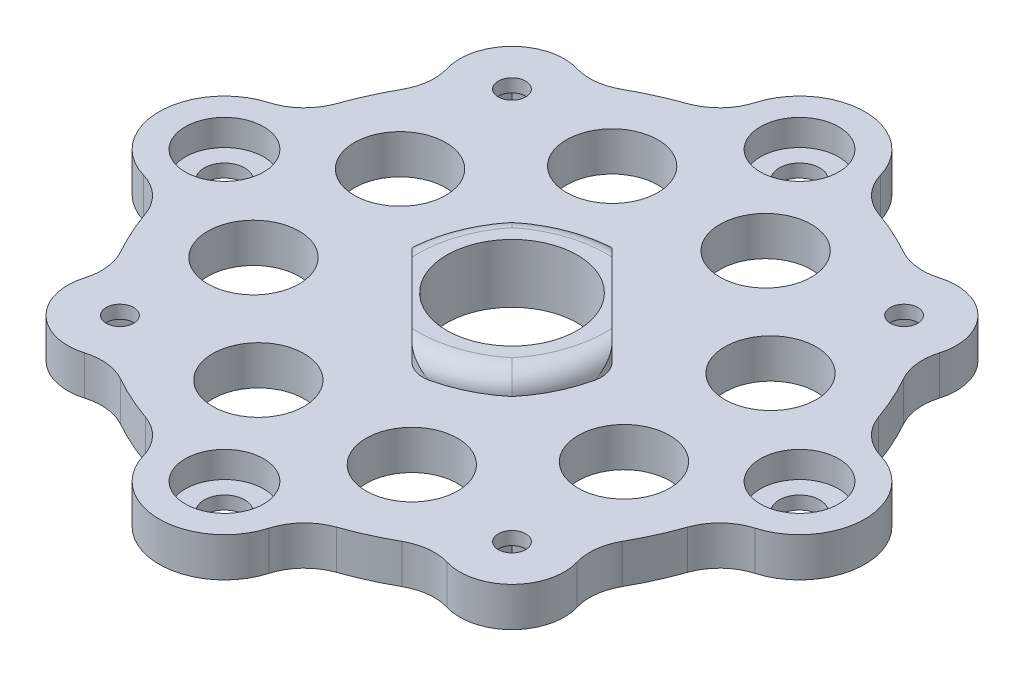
SolidWorks part; units mm, degrees
ref_plane "Front Plane" through (0, 0, 0) normal (0, 0, 1) x (1, 0, 0)
ref_plane "Top Plane" through (0, 0, 0) normal (0, 1, 0) x (1, 0, 0)
ref_plane "Right Plane" through (0, 0, 0) normal (1, 0, 0) x (0, 0, -1)
sketch "Sketch3" plane through (0, 0, 0) normal (0, 1, 0) x (1, 0, 0)
  circle A0 centre (0, 0) radius 22
  dimension "D1" = 44
extrude "Boss-Extrude2" add sketch "Sketch3" along normal blind 3
sketch "Sketch4" plane through (0, 3, 0) normal (0, 1, 0) x (1, 0, 0)
  line L0 (0, 0) -> (-39.2459, 0) construction
  circle A0 centre (-22, 0) radius 5
  circle A1 centre (0, 0) radius 22 construction
  circle A3 centre (0, 22) radius 5
  circle A4 centre (22, 0) radius 5
  circle A5 centre (0, -22) radius 5
  point P16 (0, 0)
  dimension "D1" = 10
  dimension "D2" = 4
extrude "Boss-Extrude3" add sketch "Sketch4" against normal blind 3
sketch "Sketch5" plane through (0, 3, 0) normal (0, 1, 0) x (1, 0, 0)
  circle A0 centre (-22, 0) radius 1.55
  circle A1 centre (22, 0) radius 1.55
  circle A2 centre (0, 22) radius 1.55
  circle A3 centre (0, -22) radius 1.55
  dimension "D1" = 3.1
extrude "Cut-Extrude1" cut sketch "Sketch5" against normal through all
sketch "Sketch6" plane through (0, 3, 0) normal (0, 1, 0) x (1, 0, 0)
  circle A0 centre (0, 22) radius 3
  circle A1 centre (22, 0) radius 3
  circle A2 centre (-22, 0) radius 3
  circle A3 centre (0, -22) radius 3
  dimension "D1" = 6
extrude "Cut-Extrude2" cut sketch "Sketch6" against normal blind 2
sketch "Sketch7" plane through (0, 0, 0) normal (0, -1, 0) x (1, 0, 0)
  line L1 (-15, 15) -> (15, 15) construction
  line L2 (-15, 15) -> (-15, -15) construction
  line L3 (-15, -15) -> (15, -15) construction
  line L4 (15, 15) -> (15, -15) construction
  line L5 (-15, 15) -> (15, -15) construction
  line L6 (-15, -15) -> (15, 15) construction
  circle A0 centre (15, -15) radius 4
  circle A1 centre (-15, -15) radius 4
  circle A2 centre (-15, 15) radius 4
  circle A3 centre (15, 15) radius 4
  point P0 (0, 0)
  dimension "D2" = 8
  dimension "D1" = 30
extrude "Boss-Extrude4" add sketch "Sketch7" against normal through all
sketch "Sketch8" plane through (0, 0, 0) normal (0, -1, 0) x (1, 0, 0)
  circle A0 centre (15, 15) radius 1.05
  circle A1 centre (-15, 15) radius 1.05
  circle A2 centre (-15, -15) radius 1.05
  circle A3 centre (15, -15) radius 1.05
  arc A5 (18.1125, 12.4875) -> (12.4875, 18.1125) centre (15, 15) ccw construction
  dimension "D1" = 2.1
extrude "Cut-Extrude3" cut sketch "Sketch8" against normal through all
sketch "Sketch9" plane through (0, 0, 0) normal (0, -1, 0) x (1, 0, 0)
  line L0 (0, 0) -> (15, 15) construction
  line L1 (16.633, 16.633) -> (14.4023, 17.2307)
  line L2 (14.4023, 17.2307) -> (12.7693, 15.5977)
  line L3 (12.7693, 15.5977) -> (13.367, 13.367)
  line L4 (13.367, 13.367) -> (15.5977, 12.7693)
  line L5 (15.5977, 12.7693) -> (17.2307, 14.4023)
  line L6 (17.2307, 14.4023) -> (16.633, 16.633)
  line L7 (0, 0) -> (-15, 15) construction
  line L8 (-15, -15) -> (0, 0) construction
  line L9 (0, 0) -> (15, -15) construction
  line L11 (-13.367, 13.367) -> (-12.7693, 15.5977)
  line L12 (-12.7693, 15.5977) -> (-14.4023, 17.2307)
  line L13 (-14.4023, 17.2307) -> (-16.633, 16.633)
  line L14 (-16.633, 16.633) -> (-17.2307, 14.4023)
  line L15 (-17.2307, 14.4023) -> (-15.5977, 12.7693)
  line L16 (-15.5977, 12.7693) -> (-13.367, 13.367)
  line L17 (-13.367, -13.367) -> (-15.5977, -12.7693)
  line L18 (-15.5977, -12.7693) -> (-17.2307, -14.4023)
  line L19 (-17.2307, -14.4023) -> (-16.633, -16.633)
  line L20 (-16.633, -16.633) -> (-14.4023, -17.2307)
  line L21 (-14.4023, -17.2307) -> (-12.7693, -15.5977)
  line L22 (-12.7693, -15.5977) -> (-13.367, -13.367)
  line L23 (13.367, -13.367) -> (12.7693, -15.5977)
  line L24 (12.7693, -15.5977) -> (14.4023, -17.2307)
  line L25 (14.4023, -17.2307) -> (16.633, -16.633)
  line L26 (16.633, -16.633) -> (17.2307, -14.4023)
  line L27 (17.2307, -14.4023) -> (15.5977, -12.7693)
  line L28 (15.5977, -12.7693) -> (13.367, -13.367)
  circle A0 centre (15, 15) radius 2 construction
  circle A1 centre (-15, 15) radius 2 construction
  circle A2 centre (-15, -15) radius 2 construction
  circle A3 centre (15, -15) radius 2 construction
  dimension "D1" = 4
extrude "Cut-Extrude4" cut sketch "Sketch9" against normal blind 2
sketch "Sketch10" plane through (0, 3, 0) normal (0, 1, 0) x (1, 0, 0)
  line L0 (7.65, -3.1687) -> (7.65, 0)
  line L1 (0, 7.65) -> (-3.1687, 7.65)
  line L2 (-3.1687, 7.65) -> (-7.65, 3.1687)
  line L3 (-7.65, 3.1687) -> (-7.65, 0)
  line L5 (0, -7.65) -> (3.1687, -7.65)
  line L6 (3.1687, -7.65) -> (7.65, -3.1687)
  line L8 (-11.5266, 0) -> (13.7832, 0) construction
  line L9 (-7.65, 0) -> (0, -7.65)
  line L10 (0, 7.65) -> (7.65, 0)
  line L12 (-5.4094, -5.4094) -> (-2.9198, -7.899)
  line L13 (8.0292, 2.7895) -> (5.5397, 5.2791)
  arc A0 (0, -7.65) -> (7.65, 0) centre (0, 0) ccw construction
  arc A1 (0, 7.65) -> (-7.65, 0) centre (0, 0) ccw construction
  dimension "D1" = 15.3
extrude "Boss-Extrude5" add sketch "Sketch10" along normal blind 1.5
sketch "Sketch11" plane through (0, 4.5, 0) normal (0, 1, 0) x (1, 0, 0)
  circle A0 centre (0, 0) radius 5
  dimension "D1" = 10
extrude "Cut-Extrude6" cut sketch "Sketch11" against normal through all
sketch "Sketch12" plane through (0, 3, 0) normal (0, 1, 0) x (1, 0, 0)
  line L0 (0, 0) -> (20.1265, 8.884) construction
  circle A0 centre (13.7226, 6.0573) radius 3.5
  arc A2 (21.4318, 4.9676) -> (18.1125, 12.4875) centre (0, 0) ccw construction
  circle A3 centre (13.9865, -5.4202) radius 3.5
  circle A4 centre (6.0573, -13.7226) radius 3.5
  circle A5 centre (-5.4202, -13.9865) radius 3.5
  circle A6 centre (-13.7226, -6.0573) radius 3.5
  circle A7 centre (-13.9865, 5.4202) radius 3.5
  circle A8 centre (-6.0573, 13.7226) radius 3.5
  circle A9 centre (5.4202, 13.9865) radius 3.5
  point P26 (0, 0)
  dimension "D1" = 7
  dimension "D2" = 15
  dimension "D3" = 8
extrude "Cut-Extrude7" cut sketch "Sketch12" against normal through all
fillet "Fillet2" radius 4 16 edges at (-18.1125, 1.5, 12.4875) (-12.4875, 1.5, 18.1125) (-4.9676, 1.5, 21.4318) (4.9676, 1.5, 21.4318) (12.4875, 1.5, 18.1125) (18.1125, 1.5, 12.4875) (21.4318, 1.5, 4.9676) (21.4318, 1.5, -4.9676) (18.1125, 1.5, -12.4875) (12.4875, 1.5, -18.1125) (4.9676, 1.5, -21.4318) (-4.9676, 1.5, -21.4318) (-12.4875, 1.5, -18.1125) (-18.1125, 1.5, -12.4875) (-21.4318, 1.5, -4.9676) (-21.4318, 1.5, 4.9676)
fillet "Fillet3" radius 10 4 edges at (7.65, 3.75, 3.1687) (-7.65, 3.75, -3.1687) (-3.1687, 3.75, -7.65) (3.1687, 3.75, 7.65)
fillet "Fillet4" radius 2 4 edges at (0, 3.75, -7.65) (7.65, 3.75, 0) (-7.65, 3.75, 0) (0, 3.75, 7.65)
fillet "Fillet5" radius 1.5 4 edges at (-6.6807, 4.5, -3.378) (-3.378, 4.5, -6.6807) (3.378, 4.5, 6.6807) (6.6807, 4.5, 3.378)
